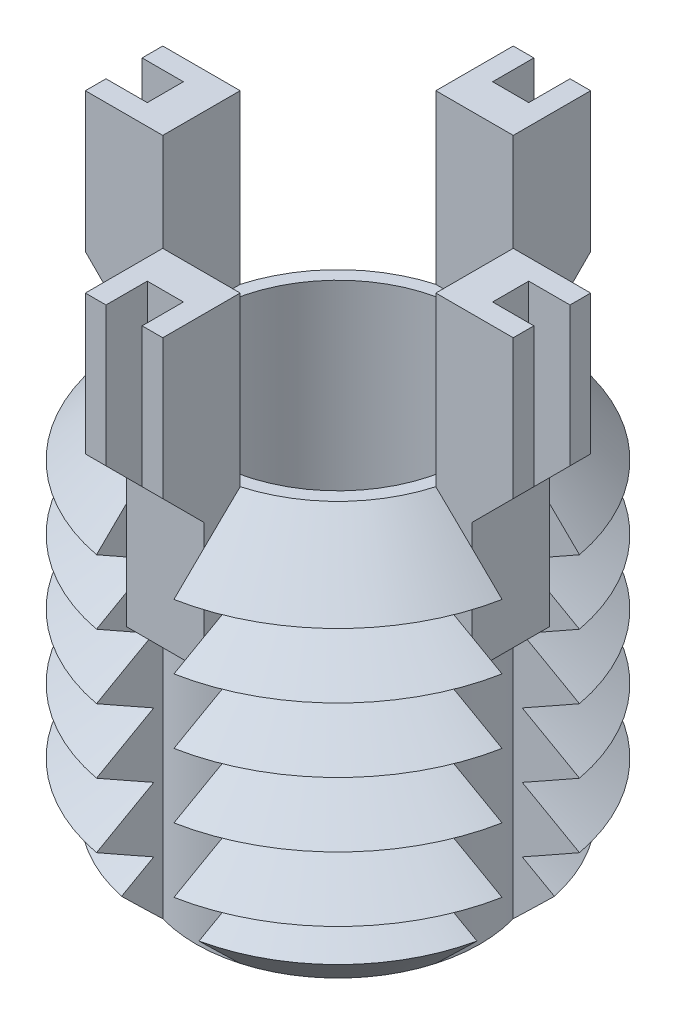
SolidWorks part; units mm, degrees
ref_plane "Front Plane" through (0, 0, 0) normal (0, 0, 1) x (1, 0, 0)
ref_plane "Top Plane" through (0, 0, 0) normal (0, 1, 0) x (1, 0, 0)
ref_plane "Right Plane" through (0, 0, 0) normal (1, 0, 0) x (0, 0, -1)
sketch "Sketch1" plane through (0, 0, 0) normal (0, 1, 0) x (1, 0, 0)
  circle A0 centre (0, 0) radius 4
  dimension "D1" = 8
extrude "Boss-Extrude1" add sketch "Sketch1" against normal blind 8
chamfer "Chamfer1" distance 1.25 angle 45 2 edges at (0, -8, 4) (0, 0, 4)
sketch "Sketch2" plane through (0, 0, 0) normal (1, 0, 0) x (0, 0, -1)
  line L0 (0, 0.8859) -> (0, -9.2617) construction
sketch "Sketch3" plane through (0, 0, 0) normal (1, 0, 0) x (0, 0, -1)
  line L0 (-4, -1.25) -> (-2.9175, -1.875)
  line L1 (-2.9175, -1.875) -> (-4, -2.5)
  line L2 (-4, -1.25) -> (-4, -6.75) construction
  line L3 (-4, -2.5) -> (-4, -1.25)
  dimension "D1" = 1.25
revolve "Cut-Revolve1" cut sketch "Sketch3" angle 360 about L0
pattern_linear "LPattern1" count 5 spacing 1.25 along (0, -1, 0) of "Cut-Revolve1"
sketch "Sketch4" plane through (0, 0, 0) normal (0, 1, 0) x (1, 0, 0)
  line L0 (-2.6458, 0.75) -> (-3.9291, 0.75)
  line L2 (-3.9291, -0.75) -> (-2.6458, -0.75)
  arc A0 (-2.6458, 0.75) -> (-2.6458, -0.75) centre (0, 0) ccw
  arc A1 (-3.9291, 0.75) -> (-3.9291, -0.75) centre (0, 0) ccw
  circle A2 centre (0, 0) radius 4 construction
  circle A3 centre (0, 0) radius 2.75 construction
  point P1 (-2.75, 0)
  point P3 (-4, 0)
  point P13 (0, 0)
  dimension "D1" = 1.5
extrude "Cut-Extrude1" cut sketch "Sketch4" against normal up to surface (8 mm away)
pattern_circular "CirPattern1" count 4 over 360 about axis through (0, 0, 0) along (0, 1, 0) of "Cut-Extrude1"
sketch "Sketch5" plane through (0, 0, 0) normal (1, 0, 0) x (0, 0, -1)
  line L0 (-2.6458, 3.25) -> (-2.6458, -2.75)
  line L1 (-2.6458, -2.75) -> (-3.3458, -2.75)
  line L2 (-3.3458, -2.75) -> (-3.3458, -0.25)
  line L3 (-3.3458, -0.25) -> (-4.1458, 0.55)
  line L4 (-4.1458, 0.55) -> (-4.1458, 3.25)
  line L5 (-4.1458, 3.25) -> (-2.6458, 3.25)
  line L6 (-3.9291, -3.75) -> (-0.75, -3.75) construction
  point P9 (-0.75, 0)
  point P10 (-3.3458, -0.25)
  dimension "D1" = 1
  dimension "D2" = 6
  dimension "D3" = 3.5
  dimension "D4" = 1.5
  dimension "D5" = 0.7
  dimension "D6" = 45
extrude "Boss-Extrude3" add sketch "Sketch5" along normal mid plane 1.5
pattern_circular "CirPattern2" count 4 over 360 about axis through (0, 0, 0) along (0, 1, 0) of "Boss-Extrude3"
sketch "Sketch6" plane through (0, 3.25, 0) normal (0, 1, 0) x (1, 0, 0)
  line L0 (-4.1458, -0.75) -> (-4.1458, 0.75) construction
  line L1 (-4.1458, -0.35) -> (-3.3458, -0.35)
  line L2 (-4.1458, -0.35) -> (-4.1458, 0.35)
  line L3 (-4.1458, 0.35) -> (-3.3458, 0.35)
  line L4 (-3.3458, -0.35) -> (-3.3458, 0.35)
  line L5 (-4.1458, -0.35) -> (-3.3458, 0.35) construction
  line L6 (-4.1458, 0.35) -> (-3.3458, -0.35) construction
  line L7 (4.1458, 0.75) -> (4.1458, -0.75) construction
  line L8 (-0.35, 3.3458) -> (0.35, 3.3458)
  line L9 (-0.35, 3.3458) -> (-0.35, 4.1458)
  line L10 (-0.35, 4.1458) -> (0.35, 4.1458)
  line L11 (0.35, 3.3458) -> (0.35, 4.1458)
  line L12 (-0.35, 3.3458) -> (0.35, 4.1458) construction
  line L13 (-0.35, 4.1458) -> (0.35, 3.3458) construction
  line L14 (3.3458, -0.35) -> (4.1458, -0.35)
  line L15 (3.3458, -0.35) -> (3.3458, 0.35)
  line L16 (3.3458, 0.35) -> (4.1458, 0.35)
  line L17 (4.1458, -0.35) -> (4.1458, 0.35)
  line L18 (3.3458, -0.35) -> (4.1458, 0.35) construction
  line L19 (3.3458, 0.35) -> (4.1458, -0.35) construction
  line L20 (-0.35, -4.1458) -> (0.35, -4.1458)
  line L21 (-0.35, -4.1458) -> (-0.35, -3.3458)
  line L22 (-0.35, -3.3458) -> (0.35, -3.3458)
  line L23 (0.35, -4.1458) -> (0.35, -3.3458)
  line L24 (-0.35, -4.1458) -> (0.35, -3.3458) construction
  line L25 (-0.35, -3.3458) -> (0.35, -4.1458) construction
  line L26 (-0.75, 4.1458) -> (0.75, 4.1458) construction
  line L27 (0.75, -4.1458) -> (-0.75, -4.1458) construction
  point P0 (-3.7458, 0)
  point P7 (-4.1458, 0)
  point P8 (-4.1458, 0)
  point P9 (0, 3.7458)
  point P14 (3.7458, 0)
  point P19 (0, -3.7458)
  point P24 (0, 4.1458)
  point P25 (4.1458, 0)
  point P26 (4.1458, 0)
  point P27 (0, 4.1458)
  point P30 (0, -4.1458)
  point P33 (0, -4.1458)
  dimension "D1" = 0.7
  dimension "D2" = 0.8
extrude "Cut-Extrude3" cut sketch "Sketch6" against normal through all both and the other way through all
sketch "Sketch7" plane through (0, 0, 0) normal (0, 1, 0) x (1, 0, 0)
  circle A0 centre (0, 0) radius 2.5
  dimension "D1" = 5
extrude "Cut-Extrude4" cut sketch "Sketch7" against normal up to surface (8 mm away)
